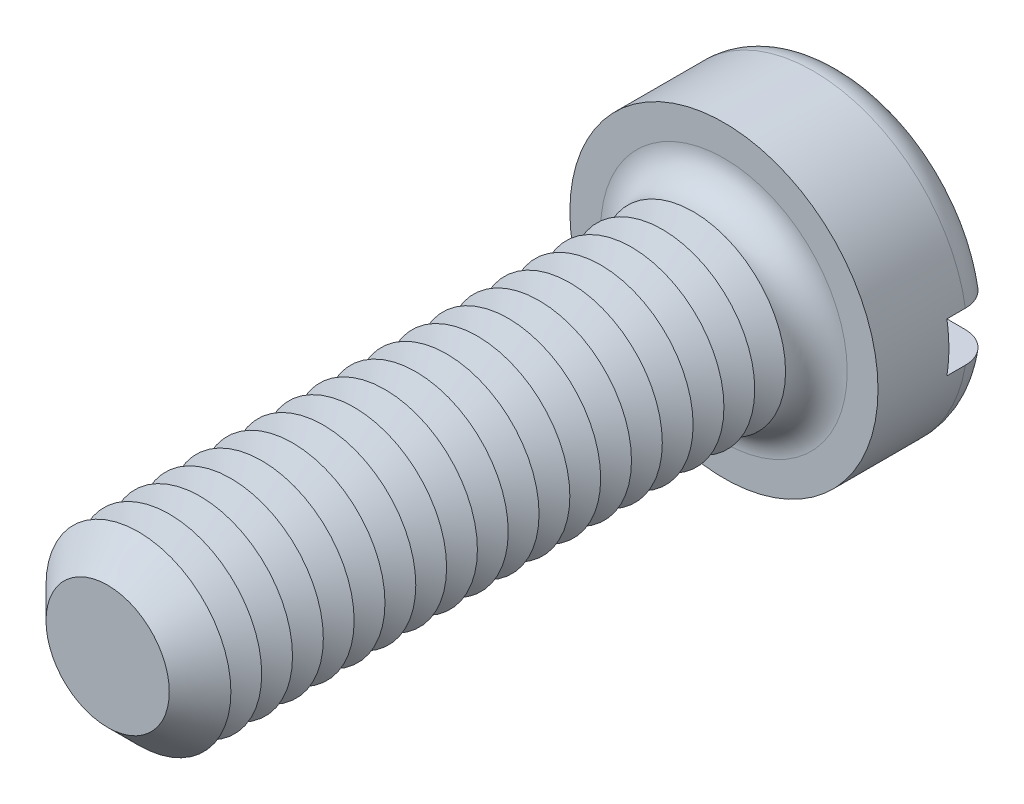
SolidWorks part; units mm, degrees
ref_plane "Front Plane" through (0, 0, 0) normal (0, 0, 1) x (1, 0, 0)
ref_plane "Top Plane" through (0, 0, 0) normal (0, 1, 0) x (1, 0, 0)
ref_plane "Right Plane" through (0, 0, 0) normal (1, 0, 0) x (0, 0, -1)
sketch "Sketch3" plane through (0, 0, 0) normal (0, 0, 1) x (1, 0, 0)
  circle A0 centre (0, 0) radius 5
  dimension "D1" = 10
extrude "Boss-Extrude2" add sketch "Sketch3" against normal blind 3.9
sketch "Sketch4" plane through (0, 0, 0) normal (0, 0, 1) x (1, 0, 0)
  circle A0 centre (0, 0) radius 3
  dimension "D1" = 6
extrude "Boss-Extrude3" add sketch "Sketch4" along normal blind 20
fillet "Fillet1" radius 1 2 edges at (5, 0, -3.9) (3, 0, 0)
chamfer "Chamfer1" distance 1 angle 45 1 edges at (3, 0, 20)
sketch "Sketch5" plane through (0, 0, 0) normal (1, 0, 0) x (0, 0, -1)
  line L0 (1.6944, 0) -> (-7.6738, 0) construction
sketch "Sketch6" plane through (0, 0, 0) normal (1, 0, 0) x (0, 0, -1)
  line L0 (-1, 3) -> (-1.5, 2.134)
  line L1 (-1.5, 2.134) -> (-2, 3)
  line L2 (-1, 3) -> (-19, 3) construction
  line L3 (-2, 3) -> (-1, 3)
  dimension "D1" = 1
revolve "Cut-Revolve1" cut sketch "Sketch6" angle 360 about L0
pattern_linear "LPattern1" count 18 spacing 1 along (0, 0, 1) of "Cut-Revolve1"
sketch "Sketch8" plane through (0, 0, -3.9) normal (0, 0, -1) x (-1, 0, 0)
  line L1 (5, -0.8) -> (-5, -0.8)
  line L2 (5, -0.8) -> (5, 0.8)
  line L3 (5, 0.8) -> (-5, 0.8)
  line L4 (-5, -0.8) -> (-5, 0.8)
  line L5 (5, -0.8) -> (-5, 0.8) construction
  line L6 (5, 0.8) -> (-5, -0.8) construction
  point P0 (0, 0)
  dimension "D1" = 10
  dimension "D2" = 1.6
extrude "Cut-Extrude1" cut sketch "Sketch8" against normal blind 1.6
